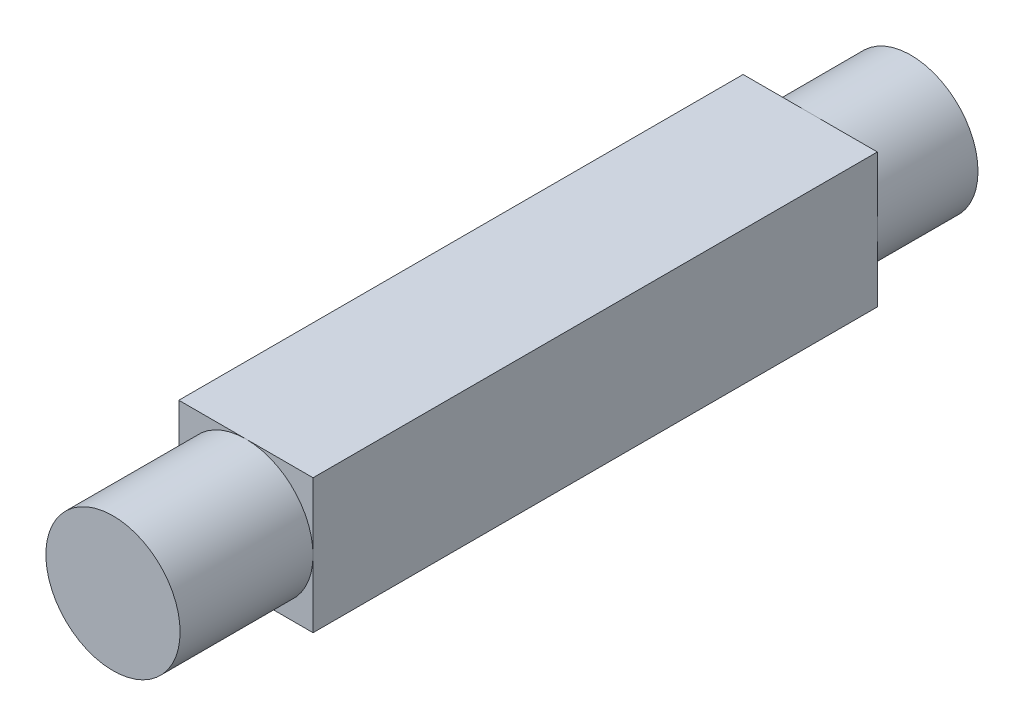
SolidWorks part; units mm, degrees
ref_plane "Front Plane" through (0, 0, 0) normal (0, 0, 1) x (1, 0, 0)
ref_plane "Top Plane" through (0, 0, 0) normal (0, 1, 0) x (1, 0, 0)
ref_plane "Right Plane" through (0, 0, 0) normal (1, 0, 0) x (0, 0, -1)
sketch "Sketch1" plane through (0, 0, 0) normal (0, 0, 1) x (1, 0, 0)
  line L1 (-4.7625, 4.7625) -> (4.7625, 4.7625)
  line L2 (-4.7625, 4.7625) -> (-4.7625, -4.7625)
  line L3 (-4.7625, -4.7625) -> (4.7625, -4.7625)
  line L4 (4.7625, 4.7625) -> (4.7625, -4.7625)
  line L5 (-4.7625, 4.7625) -> (4.7625, -4.7625) construction
  line L6 (-4.7625, -4.7625) -> (4.7625, 4.7625) construction
  point P0 (0, 0)
  dimension "D1" = 9.525
  dimension "D2" = 9.525
extrude "Boss-Extrude1" add sketch "Sketch1" along normal blind 84.5566
ref_plane "Plane1" through (0, 0, 73.4035) normal (0, 0, 1) x (1, 0, 0)
sketch "Sketch2" plane through (0, 0, 73.4035) normal (0, 0, 1) x (1, 0, 0)
  circle A0 centre (0, 0) radius 4.7625
  dimension "D1" = 9.525
extrude "Cut-Extrude2" cut sketch "Sketch2" along normal through all flip side to cut
ref_plane "Plane2" through (0, 0, 32.0937) normal (0, 0, 1) x (1, 0, 0)
sketch "Sketch3" plane through (0, 0, 32.0937) normal (0, 0, 1) x (1, 0, 0)
  circle A0 centre (0, 0) radius 4.7625
  dimension "D1" = 9.525
extrude "Cut-Extrude3" [suppressed] cut sketch "Sketch3" against normal blind 84.5566 flip side to cut
sketch "Sketch4" plane through (0, 0, 0) normal (0, 0, -1) x (-1, 0, 0)
  circle A0 centre (0, 0) radius 4.7625
  dimension "D1" = 9.525
extrude "Cut-Extrude5" cut sketch "Sketch4" against normal blind 7.1425 flip side to cut
sketch "Sketch5" plane through (0, 0, 84.5566) normal (0, 0, 1) x (1, 0, 0)
  line L1 (5.0955, 6.6953) -> (-5.0955, 6.6953)
  line L2 (5.0955, 6.6953) -> (5.0955, -6.6953)
  line L3 (5.0955, -6.6953) -> (-5.0955, -6.6953)
  line L4 (-5.0955, 6.6953) -> (-5.0955, -6.6953)
  line L5 (5.0955, 6.6953) -> (-5.0955, -6.6953) construction
  line L6 (5.0955, -6.6953) -> (-5.0955, 6.6953) construction
  circle A0 centre (0, 0) radius 4.7625
  arc A1 (-5.6596, -6.2258) -> (-4.4925, -7.114) centre (0, 0) ccw construction
extrude "Cut-Extrude6" cut sketch "Sketch5" against normal blind 37.3738
sketch "Sketch6" plane through (0, 0, 84.5566) normal (0, 0, 1) x (1, 0, 0)
  circle A0 centre (0, 0) radius 4.7625
extrude "Cut-Extrude7" cut sketch "Sketch6" against normal blind 27.94
